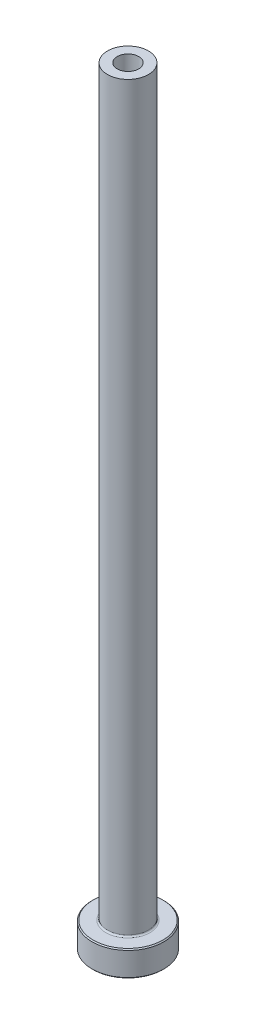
SolidWorks part; units mm, degrees
ref_plane "Front Plane" through (0, 0, 0) normal (0, 0, 1) x (1, 0, 0)
ref_plane "Top Plane" through (0, 0, 0) normal (0, 1, 0) x (1, 0, 0)
ref_plane "Right Plane" through (0, 0, 0) normal (1, 0, 0) x (0, 0, -1)
sketch "Sketch1" plane through (0, 0, 0) normal (0, 0, 1) x (1, 0, 0)
  line L0 (-2.1, 150) -> (-4, 150)
  line L1 (-4, 150) -> (-4, 5)
  line L2 (-4, 5) -> (-7, 5)
  line L3 (-7, 5) -> (-7, 0)
  line L4 (7.7, 0) -> (-7.7, 0) construction
  line L5 (-7, 0) -> (-2.35, 0)
  line L6 (-2.1, 105) -> (-2.1, 150)
  line L7 (0, 92.1877) -> (0, -15.5353) construction
  line L8 (0, -7.7) -> (0, 7.7) construction
  line L9 (-2.1, 105) -> (-2.35, 93)
  line L10 (-2.35, 93) -> (-2.35, 0)
  dimension "D1" = 0.25
  dimension "ID" = 4.2
  dimension "OD" = 8
  dimension "L" = 150
  dimension "H" = 14
  dimension "T" = 5
  dimension "N" = 45
  dimension "D2" = 12
revolve "Revolve1" add sketch "Sketch1" angle 360 about L7
fillet "Fillet1" radius 0.3 1 edges at (0, 5, 4)
chamfer "Chamfer1" distance 0.2 angle 45 2 edges at (0, 5, 7) (0, 0, 7)
chamfer "Chamfer3" distance 0.5 angle 45 1 edges at (0, 0, 2.35)
